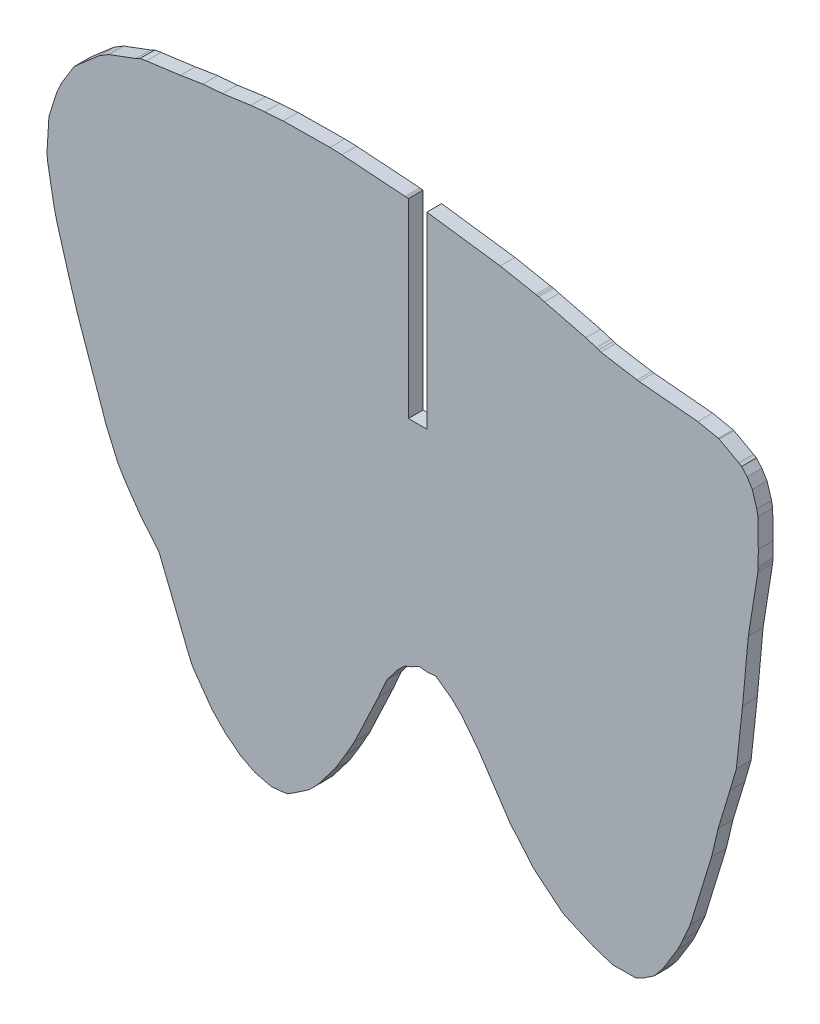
SolidWorks part; units mm, degrees
ref_plane "Спереди" through (0, 0, 0) normal (0, 0, 1) x (1, 0, 0)
ref_plane "Сверху" through (0, 0, 0) normal (0, 1, 0) x (1, 0, 0)
ref_plane "Справа" through (0, 0, 0) normal (1, 0, 0) x (0, 0, -1)
sketch "Model" plane through (0, 0, 0) normal (0, 0, 1) x (1, 0, 0)
  line L0 (-5863.5632, 44.1137) -> (-5863.8686, 44.2284)
  line L1 (-5863.8686, 44.2284) -> (-5864.1739, 44.3431)
  line L2 (-5864.1739, 44.3431) -> (-5865.6071, 44.7831)
  line L3 (-5865.6071, 44.7831) -> (-5871.2149, 46.1887)
  line L4 (-5871.2149, 46.1887) -> (-5871.9777, 46.4134)
  line L5 (-5871.9777, 46.4134) -> (-5872.1797, 46.4418)
  line L6 (-5872.1797, 46.4418) -> (-5872.3816, 46.4702)
  line L7 (-5872.3816, 46.4702) -> (-5877.1975, 47.4062)
  line L8 (-5877.1975, 47.4062) -> (-5887.1419, 48.7514)
  line L9 (-5887.1419, 48.7514) -> (-5887.1419, 23.2852)
  line L10 (-5887.1419, 23.2852) -> (-5887.3919, 23.2852)
  line L11 (-5887.3919, 23.2852) -> (-5889.3919, 23.2852)
  line L12 (-5889.3919, 23.2852) -> (-5889.6419, 23.2852)
  line L13 (-5889.6419, 23.2852) -> (-5889.6419, 49.081)
  line L14 (-5889.6419, 49.081) -> (-5889.7779, 49.0973)
  line L15 (-5889.7779, 49.0973) -> (-5889.942, 49.1122)
  line L16 (-5889.942, 49.1122) -> (-5890.1061, 49.127)
  line L17 (-5890.1061, 49.127) -> (-5898.6709, 49.7298)
  line L18 (-5898.6709, 49.7298) -> (-5900.2594, 49.7837)
  line L19 (-5900.2594, 49.7837) -> (-5906.5927, 49.7165)
  line L20 (-5906.5927, 49.7165) -> (-5909.084, 49.5436)
  line L21 (-5909.084, 49.5436) -> (-5910.991, 49.357)
  line L22 (-5910.991, 49.357) -> (-5914.8149, 48.8191)
  line L23 (-5914.8149, 48.8191) -> (-5917.4834, 48.6007)
  line L24 (-5917.4834, 48.6007) -> (-5920.5179, 48.1192)
  line L25 (-5920.5179, 48.1192) -> (-5925.1518, 47.4914)
  line L26 (-5925.1518, 47.4914) -> (-5925.9941, 47.3595)
  line L27 (-5925.9941, 47.3595) -> (-5926.5838, 47.0578)
  line L28 (-5926.5838, 47.0578) -> (-5930.2285, 45.7007)
  line L29 (-5930.2285, 45.7007) -> (-5931.5232, 44.9167)
  line L30 (-5931.5232, 44.9167) -> (-5934.2935, 42.5297)
  line L31 (-5934.2935, 42.5297) -> (-5934.9411, 41.9267)
  line L32 (-5934.9411, 41.9267) -> (-5936.6293, 39.1768)
  line L33 (-5936.6293, 39.1768) -> (-5937.2337, 37.8574)
  line L34 (-5937.2337, 37.8574) -> (-5938.2955, 34.5551)
  line L35 (-5938.2955, 34.5551) -> (-5938.3697, 33.9931)
  line L36 (-5938.3697, 33.9931) -> (-5938.6111, 29.9561)
  line L37 (-5938.6111, 29.9561) -> (-5938.5282, 29.0179)
  line L38 (-5938.5282, 29.0179) -> (-5937.6302, 24.0053)
  line L39 (-5937.6302, 24.0053) -> (-5937.2335, 22.4333)
  line L40 (-5937.2335, 22.4333) -> (-5935.6421, 16.9511)
  line L41 (-5935.6421, 16.9511) -> (-5934.473, 13.1571)
  line L42 (-5934.473, 13.1571) -> (-5930.5729, 2.0142)
  line L43 (-5930.5729, 2.0142) -> (-5929.0115, -1.5977)
  line L44 (-5929.0115, -1.5977) -> (-5927.9432, -3.3532)
  line L45 (-5927.9432, -3.3532) -> (-5925.9771, -6.1894)
  line L46 (-5925.9771, -6.1894) -> (-5923.444, -9.2365)
  line L47 (-5923.444, -9.2365) -> (-5919.52, -18.9817)
  line L48 (-5919.52, -18.9817) -> (-5918.962, -20.28)
  line L49 (-5918.962, -20.28) -> (-5918.6303, -20.8015)
  line L50 (-5918.6303, -20.8015) -> (-5916.2527, -24.1468)
  line L51 (-5916.2527, -24.1468) -> (-5914.456, -26.0067)
  line L52 (-5914.456, -26.0067) -> (-5912.3484, -27.6546)
  line L53 (-5912.3484, -27.6546) -> (-5910.4528, -28.6436)
  line L54 (-5910.4528, -28.6436) -> (-5909.1631, -28.9599)
  line L55 (-5909.1631, -28.9599) -> (-5908.2074, -29.1916)
  line L56 (-5908.2074, -29.1916) -> (-5906.894, -29.0714)
  line L57 (-5906.894, -29.0714) -> (-5906.0158, -28.9392)
  line L58 (-5906.0158, -28.9392) -> (-5905.1091, -28.3714)
  line L59 (-5905.1091, -28.3714) -> (-5903.0823, -26.992)
  line L60 (-5903.0823, -26.992) -> (-5901.8685, -25.7482)
  line L61 (-5901.8685, -25.7482) -> (-5899.5667, -22.7349)
  line L62 (-5899.5667, -22.7349) -> (-5898.1513, -20.4048)
  line L63 (-5898.1513, -20.4048) -> (-5896.8963, -18.1919)
  line L64 (-5896.8963, -18.1919) -> (-5893.7134, -11.4439)
  line L65 (-5893.7134, -11.4439) -> (-5892.5986, -8.8952)
  line L66 (-5892.5986, -8.8952) -> (-5891.1249, -6.959)
  line L67 (-5891.1249, -6.959) -> (-5890.1272, -5.9983)
  line L68 (-5890.1272, -5.9983) -> (-5889.1884, -5.6214)
  line L69 (-5889.1884, -5.6214) -> (-5888.1608, -5.0754)
  line L70 (-5888.1608, -5.0754) -> (-5887.1645, -5.1916)
  line L71 (-5887.1645, -5.1916) -> (-5885.8962, -5.0954)
  line L72 (-5885.8962, -5.0954) -> (-5883.7462, -6.6745)
  line L73 (-5883.7462, -6.6745) -> (-5882.4505, -7.9116)
  line L74 (-5882.4505, -7.9116) -> (-5880.1731, -10.8319)
  line L75 (-5880.1731, -10.8319) -> (-5875.7422, -17.4769)
  line L76 (-5875.7422, -17.4769) -> (-5874.7675, -18.544)
  line L77 (-5874.7675, -18.544) -> (-5872.6901, -21.0195)
  line L78 (-5872.6901, -21.0195) -> (-5868.9245, -24.1254)
  line L79 (-5868.9245, -24.1254) -> (-5868.8312, -24.1963)
  line L80 (-5868.8312, -24.1963) -> (-5868.738, -24.2672)
  line L81 (-5868.738, -24.2672) -> (-5868.2444, -24.5264)
  line L82 (-5868.2444, -24.5264) -> (-5864.6068, -26.1127)
  line L83 (-5864.6068, -26.1127) -> (-5862.0447, -26.9508)
  line L84 (-5862.0447, -26.9508) -> (-5861.7205, -26.9741)
  line L85 (-5861.7205, -26.9741) -> (-5858.8231, -26.953)
  line L86 (-5858.8231, -26.953) -> (-5857.8641, -26.4746)
  line L87 (-5857.8641, -26.4746) -> (-5856.3588, -25.4843)
  line L88 (-5856.3588, -25.4843) -> (-5855.2275, -24.1364)
  line L89 (-5855.2275, -24.1364) -> (-5853.087, -20.6459)
  line L90 (-5853.087, -20.6459) -> (-5852.4504, -19.2992)
  line L91 (-5852.4504, -19.2992) -> (-5851.4537, -17.0187)
  line L92 (-5851.4537, -17.0187) -> (-5848.5583, -7.5932)
  line L93 (-5848.5583, -7.5932) -> (-5847.6707, -3.8197)
  line L94 (-5847.6707, -3.8197) -> (-5846.0706, 1.4416)
  line L95 (-5846.0706, 1.4416) -> (-5845.2095, 4.3943)
  line L96 (-5845.2095, 4.3943) -> (-5844.367, 12.2277)
  line L97 (-5844.367, 12.2277) -> (-5843.5846, 20.7838)
  line L98 (-5843.5846, 20.7838) -> (-5842.2944, 28.9309)
  line L99 (-5842.2944, 28.9309) -> (-5842.271, 29.2725)
  line L100 (-5842.271, 29.2725) -> (-5842.2477, 29.6142)
  line L101 (-5842.2477, 29.6142) -> (-5842.2384, 31.6282)
  line L102 (-5842.2384, 31.6282) -> (-5842.2868, 35.451)
  line L103 (-5842.2868, 35.451) -> (-5842.3628, 35.8576)
  line L104 (-5842.3628, 35.8576) -> (-5842.4388, 36.2642)
  line L105 (-5842.4388, 36.2642) -> (-5843.047, 38.256)
  line L106 (-5843.047, 38.256) -> (-5843.7513, 39.4009)
  line L107 (-5843.7513, 39.4009) -> (-5844.5002, 40.2285)
  line L108 (-5844.5002, 40.2285) -> (-5844.8627, 40.4548)
  line L109 (-5844.8627, 40.4548) -> (-5847.517, 41.9156)
  line L110 (-5847.517, 41.9156) -> (-5847.5854, 41.939)
  line L111 (-5847.5854, 41.939) -> (-5847.6537, 41.9624)
  line L112 (-5847.6537, 41.9624) -> (-5850.423, 42.5281)
  line L113 (-5850.423, 42.5281) -> (-5858.3848, 43.2599)
  line L114 (-5858.3848, 43.2599) -> (-5858.6548, 43.307)
  line L115 (-5858.6548, 43.307) -> (-5863.5632, 44.1137)
extrude "Бобышка-Вытянуть1" add sketch "Model" along normal blind 2
